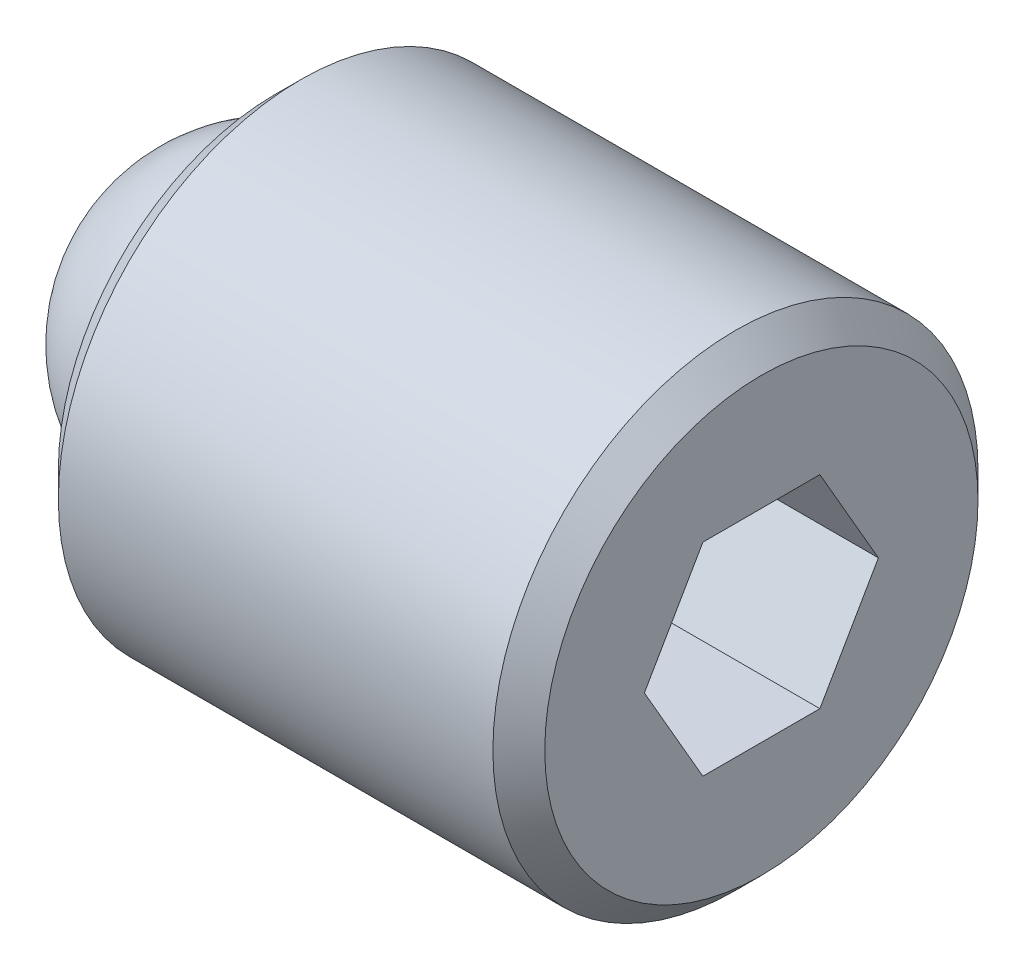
SolidWorks part; units mm, degrees
ref_plane "Front Plane" through (0, 0, 0) normal (0, 0, 1) x (1, 0, 0)
ref_plane "Top Plane" through (0, 0, 0) normal (0, 1, 0) x (1, 0, 0)
ref_plane "Right Plane" through (0, 0, 0) normal (1, 0, 0) x (0, 0, -1)
sketch "Sketch2" plane through (0, 0, 0) normal (1, 0, 0) x (0, 0, -1)
  circle A0 centre (0, 0) radius 2.3749
  dimension "D1" = 4.7498
extrude "Boss-Extrude1" add sketch "Sketch2" along normal blind 4.7625
sketch "Sketch3" plane through (0, 0, 0) normal (-1, 0, 0) x (0, 0, 1)
  circle A0 centre (0, 0) radius 1.5875
  dimension "D1" = 3.175
chamfer "Chamfer1" distance 0.254 angle 45 1 edges at (0, 0, -2.3749)
chamfer "Chamfer2" distance 0.254 angle 45 1 edges at (4.7625, 0, -2.3749)
sketch "Sketch4" plane through (4.7625, 0, 0) normal (1, 0, 0) x (0, 0, -1)
  line L1 (1.1457, 0) -> (0.5728, 0.9922)
  line L2 (0.5728, 0.9922) -> (-0.5728, 0.9922)
  line L3 (-0.5728, 0.9922) -> (-1.1457, 0)
  line L4 (-1.1457, 0) -> (-0.5728, -0.9922)
  line L5 (-0.5728, -0.9922) -> (0.5728, -0.9922)
  line L6 (0.5728, -0.9922) -> (1.1457, 0)
  circle A0 centre (0, 0) radius 0.9922 construction
extrude "Cut-Extrude2" cut sketch "Sketch4" against normal blind 2.286
extrude "Cut-Extrude3" cut sketch "Sketch3" against normal blind 1.5875
sketch "Sketch5" plane through (0, 0, 0) normal (-1, 0, 0) x (0, 0, 1)
  line L0 (0, 0) -> (0, -1.5875)
  line L1 (0, 0) -> (0, 1.5875)
  arc A0 (0, 1.5875) -> (0, -1.5875) centre (0, 0) ccw
revolve "Revolve1" add sketch "Sketch5" angle 360 about L1
